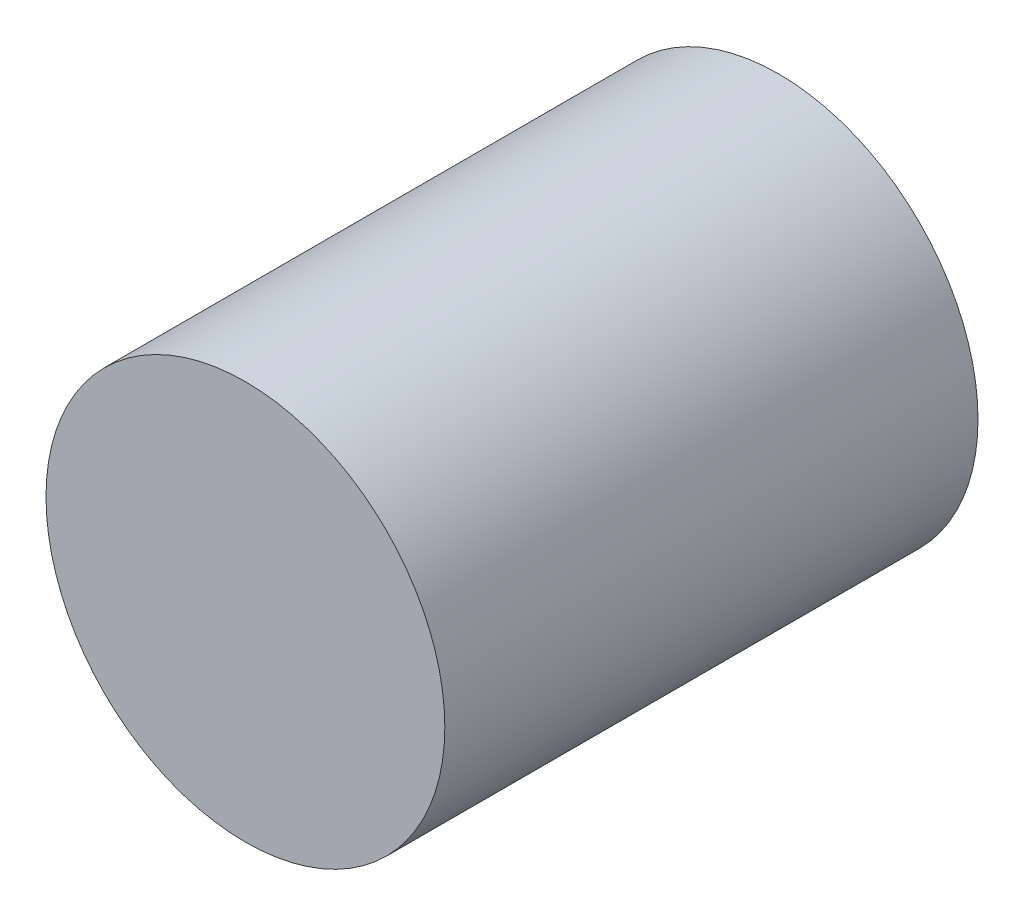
SolidWorks part; units mm, degrees
ref_plane "Ebene vorne" through (0, 0, 0) normal (0, 0, 1) x (1, 0, 0)
ref_plane "Ebene oben" through (0, 0, 0) normal (0, 1, 0) x (1, 0, 0)
ref_plane "Ebene rechts" through (0, 0, 0) normal (1, 0, 0) x (0, 0, -1)
sketch "Skizze1" plane through (0, 0, 0) normal (0, 0, 1) x (1, 0, 0)
  circle A0 centre (0, 0) radius 4.75
  dimension "D1" = 9.5
extrude "Linear austragen1" add sketch "Skizze1" along normal blind 12.7
